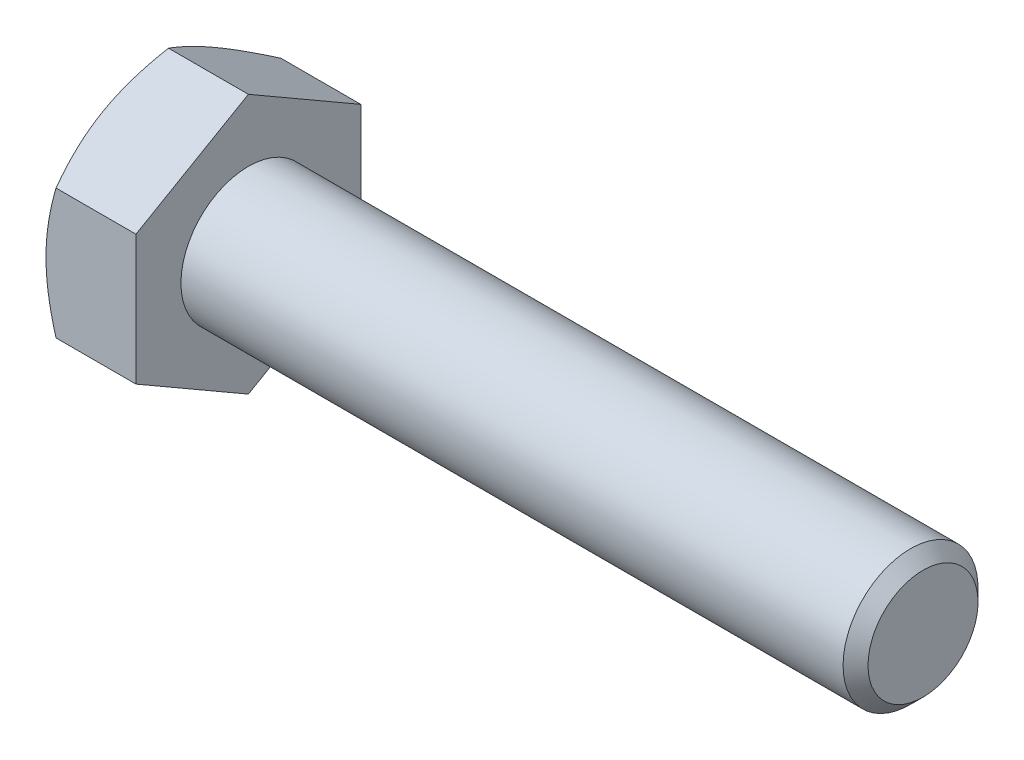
SolidWorks part; units mm, degrees
ref_plane "Plane1" through (0, 0, 0) normal (0, 0, 1) x (1, 0, 0)
ref_plane "Plane2" through (0, 0, 0) normal (0, 1, 0) x (1, 0, 0)
ref_plane "Plane3" through (0, 0, 0) normal (1, 0, 0) x (0, 0, -1)
sketch "Sketch1" plane through (0, 0, 0) normal (1, 0, 0) x (0, 0, -1)
  line L0 (5, 2.8868) -> (5, -2.8868)
  line L1 (-5, 2.8868) -> (-5, -2.8868)
  line L2 (5, -2.8868) -> (0, -5.7735)
  line L3 (0, -5.7735) -> (-5, -2.8868)
  line L4 (5, 2.8868) -> (0, 5.7735)
  line L5 (0, 5.7735) -> (-5, 2.8868)
  dimension "Width_flats" = 10
  dimension "D2" = 120
  dimension "D3" = 5
  dimension "D4" = 5
  dimension "D5" = 5
extrude "BaseHead" add sketch "Sketch1" along normal blind 4
sketch "BodySke" plane through (0, 0, 0) normal (0, 0, 1) x (1, 0, 0)
  line L1 (0, 0) -> (34, 0)
  line L2 (0, 0) -> (0, 3)
  line L4 (34, 0) -> (34, 2.4455)
  line L5 (4, 5.7735) -> (4, 2.8868) construction
  line L6 (34, 2.4455) -> (33.4455, 3)
  line L7 (0, 0) -> (110.49, 0) construction
  line L8 (34, -2.4455) -> (33.4455, -3) construction
  line L9 (0, 2.8868) -> (0, -2.8868) construction
  line L10 (5, 15.24) -> (5, -1.27) construction
  line L11 (16, 15.24) -> (16, -1.27) construction
  line L12 (4, 2.8868) -> (4, -2.8868) construction
  line L15 (0, 3) -> (33.4455, 3)
  dimension "Length" = 30
  dimension "Body_ch_ang" = 45
  dimension "Diameter" = 6
  dimension "Minor_dia" = 4.891
  dimension "Advance" = 1
  dimension "Thread_nom" = 18
revolve "BaseBody" add sketch "BodySke" angle 360 about L7
fillet "HeadFillet" [suppressed] radius 0.25
sketch "Sketch3" plane through (0, 0, 0) normal (0, 0, 1) x (1, 0, 0)
  line L0 (0, 5) -> (3.3333, 10.7735)
  line L1 (0, 5.7735) -> (0, 2.8868) construction
  line L2 (3.3333, 10.7735) -> (3.3333, 15.7735)
  line L3 (3.3333, 15.7735) -> (-10, 15.7735)
  line L4 (-10, 15.7735) -> (-10, 5)
  line L5 (-10, 5) -> (0, 5)
  line L6 (0, 0) -> (99.06, 0) construction
  line L7 (4, 5.7735) -> (0, 5.7735) construction
  dimension "D1" = 5
  dimension "D2" = 5
  dimension "D3" = 10
  dimension "D4" = 5
  dimension "Head_ch_ang" = 30
revolve "HeadChamfer" cut sketch "Sketch3" angle 360 about L6
sketch "ThdSchSke" plane through (0, 0, 0) normal (0, 0, 1) x (1, 0, 0)
  line L0 (16, -2.4455) -> (15.6117, -3)
  line L1 (16, -2.4455) -> (16.3883, -3)
  line L2 (16.3883, -3) -> (16.3883, -3.75)
  line L3 (-3.175, 0) -> (5.1513, 0) construction
  line L5 (16.3883, -3.75) -> (15.6117, -3.75)
  line L6 (15.6117, -3.75) -> (15.6117, -3)
  dimension "Thread_minor" = 4.891
  dimension "Diameter" = 6
  dimension "Start" = 16
  dimension "SideAngle" = 55
  dimension "VeeAngle" = 70
  dimension "Overcut" = 7.5
revolve "ThreadSchematic" [suppressed] cut sketch "ThdSchSke" angle 360 about L3
pattern_linear "ThdSchPat" [suppressed]
equation "\"D3@Sketch1\" = \"Width_flats@Sketch1\" / 2"
equation "\"D4@Sketch1\" = \"D3@Sketch1\""
equation "\"D5@Sketch1\" = \"D4@Sketch1\""
equation "\"Thread_minor@ThreadCosmetic\" = \"Minor_dia@BodySke\""
equation "\"D1@Sketch3\" = \"Width_flats@Sketch1\" / 2"
equation "\"Thread_length@ThreadCosmetic\" = ((sgn( (\"Length@BodySke\" - \"Advance@BodySke\" ) - \"Thread_nom@BodySke\" )-1)*( (\"Length@BodySke\" - \"Advance@BodySke\" ) - \"Thread_nom@BodySke\" ))/-2+ \"Thread_nom@BodySke\""
equation "\"Thread_minor@ThdSchSke\" = \"Minor_dia@BodySke\""
equation "\"Diameter@ThdSchSke\" = \"Diameter@BodySke\""
equation "\"Overcut@ThdSchSke\" = \"Diameter@BodySke\" * 1.25"
equation "\"Start@ThdSchSke\" = \"Head_ht@BaseHead\" + \"Length@BodySke\" - \"Thread_length@ThreadCosmetic\"  '---Non-countersunk---"
equation "\"Num_threads@ThdSchPat\" = int( \"Thread_length@ThreadCosmetic\" / \"Advance@BodySke\" + 0.999 )  + 1"
equation "\"Advance@ThdSchPat\" = \"Thread_length@ThreadCosmetic\" /  (\"Num_threads@ThdSchPat\" - 1) 'relax it"
equation "\"Num_threads@ThdSchPat\" = \"Num_threads@ThdSchPat\" - sgn( \"Num_threads@ThdSchPat\" - 1) '---chamfered tips only---"
